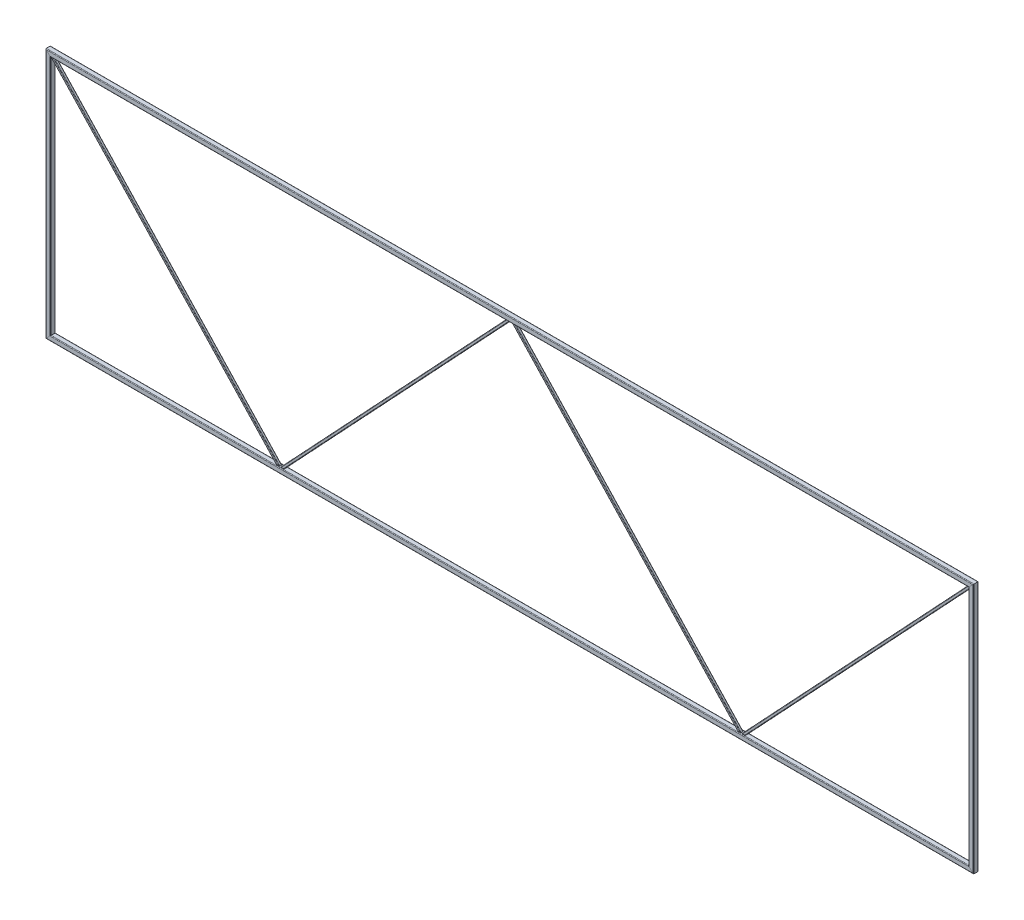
SolidWorks part; units mm, degrees
ref_plane "Alzado" through (0, 0, 0) normal (0, 0, 1) x (1, 0, 0)
ref_plane "Planta" through (0, 0, 0) normal (0, 1, 0) x (1, 0, 0)
ref_plane "Vista lateral" through (0, 0, 0) normal (1, 0, 0) x (0, 0, -1)
sketch "Croquis1" plane through (0, 0, 0) normal (0, 0, 1) x (1, 0, 0)
  line L0 (-7500, 0) -> (-3750, -4000)
  line L1 (-7500, 0) -> (7500, 0)
  line L2 (-7500, 0) -> (-7500, -4000)
  line L3 (-7500, -4000) -> (7500, -4000)
  line L4 (7500, 0) -> (7500, -4000)
  line L5 (0, 0) -> (-3750, -4000)
  line L6 (0, 0) -> (3750, -4000)
  line L7 (7500, 0) -> (3750, -4000)
  dimension "D1" = 15000
  dimension "D2" = 4000
  dimension "D3" = 3750
  dimension "D4" = 3750
other "Miembro estructural3"
ref_plane "Plano3" through (-7500, 0, 0) normal (1, 0, 0) x (0, 1, 0)
sketch "Sketch12" plane through (-7500, 0, 0) normal (1, 0, 0) x (0, 1, 0)
  line L0 (-30, -35) -> (30, -35)
  line L1 (-35, -30) -> (-35, 30)
  line L2 (30, 35) -> (-30, 35)
  line L3 (35, 30) -> (35, -30)
  line L4 (-30, -40) -> (30, -40)
  line L5 (-40, -30) -> (-40, 30)
  line L6 (30, 40) -> (-30, 40)
  line L7 (40, 30) -> (40, -30)
  arc A0 (40, 30) -> (30, 40) centre (30, 30) ccw
  arc A1 (30, -40) -> (40, -30) centre (30, -30) ccw
  arc A2 (-40, -30) -> (-30, -40) centre (-30, -30) ccw
  arc A3 (-30, 40) -> (-40, 30) centre (-30, 30) ccw
  arc A4 (-30, 35) -> (-35, 30) centre (-30, 30) ccw
  arc A5 (35, 30) -> (30, 35) centre (30, 30) ccw
  arc A6 (30, -35) -> (35, -30) centre (30, -30) ccw
  arc A7 (-35, -30) -> (-30, -35) centre (-30, -30) ccw
  point P0 (-40, 0)
  point P1 (40, 0)
  point P2 (0, 40)
  point P3 (0, -40)
  point P4 (0, 0)
  point P5 (-40, -40)
  point P6 (40, -40)
  point P7 (40, 40)
  point P8 (-40, 40)
  point P33 (0, 0)
  dimension "D1" = 10
  dimension "Thickness" = 5
  dimension "V_leg" = 80
other "Miembro estructural4"
ref_plane "Plano4" through (-7500, 0, 0) normal (0.6839, -0.7295, 0) x (0.7295, 0.6839, 0)
sketch "Sketch13" plane through (-7500, 0, 0) normal (0.6839, -0.7295, 0) x (0.7295, 0.6839, 0)
  line L0 (-12, -16) -> (12, -16)
  line L1 (-16, -12) -> (-16, 12)
  line L2 (12, 16) -> (-12, 16)
  line L3 (16, 12) -> (16, -12)
  line L4 (-12, -20) -> (12, -20)
  line L5 (-20, -12) -> (-20, 12)
  line L6 (12, 20) -> (-12, 20)
  line L7 (20, 12) -> (20, -12)
  arc A0 (20, 12) -> (12, 20) centre (12, 12) ccw
  arc A1 (12, -20) -> (20, -12) centre (12, -12) ccw
  arc A2 (-20, -12) -> (-12, -20) centre (-12, -12) ccw
  arc A3 (-12, 20) -> (-20, 12) centre (-12, 12) ccw
  arc A4 (-12, 16) -> (-16, 12) centre (-12, 12) ccw
  arc A5 (16, 12) -> (12, 16) centre (12, 12) ccw
  arc A6 (12, -16) -> (16, -12) centre (12, -12) ccw
  arc A7 (-16, -12) -> (-12, -16) centre (-12, -12) ccw
  point P0 (-20, 0)
  point P1 (20, 0)
  point P2 (0, 20)
  point P3 (0, -20)
  point P4 (0, 0)
  point P5 (-20, -20)
  point P6 (20, -20)
  point P7 (20, 20)
  point P8 (-20, 20)
  point P33 (0, 0)
  dimension "D1" = 8
  dimension "Thickness" = 4
  dimension "V_leg" = 40
other "Recortar/Extender4"
other "Recortar/Extender5"
other "Recortar/Extender6"
other "Recortar/Extender7"
other "Recortar/Extender8"
other "Recortar/Extender9"
other "Recortar/Extender10"
other "Recortar/Extender11"
